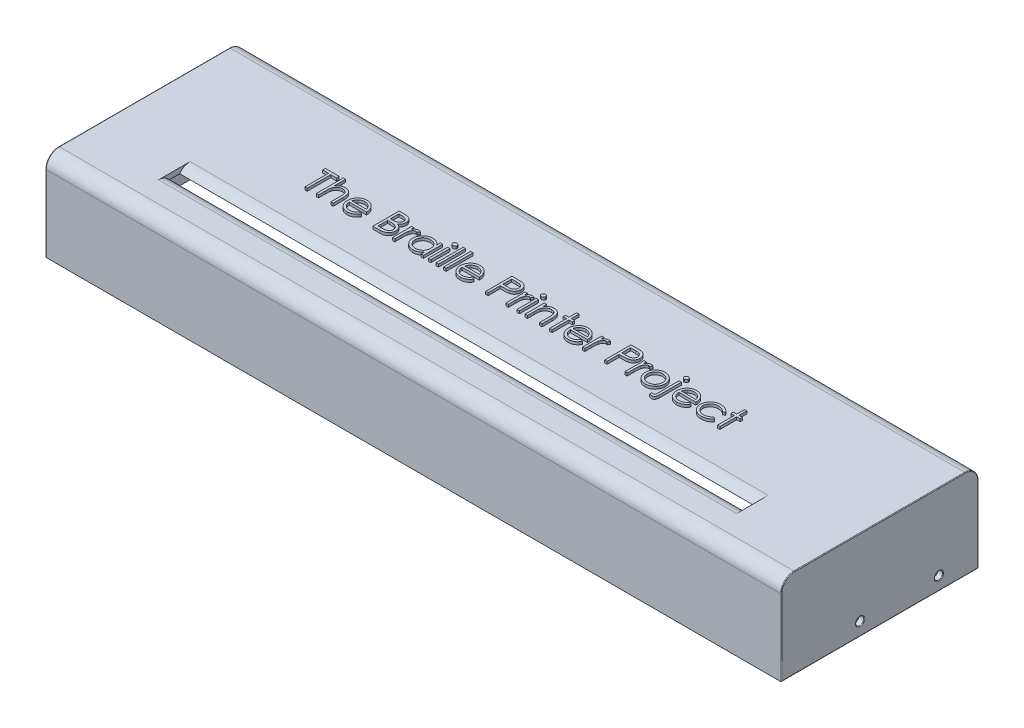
SolidWorks part; units mm, degrees
ref_plane "Piano frontale" through (0, 0, 0) normal (0, 0, 1) x (1, 0, 0)
ref_plane "Piano superiore" through (0, 0, 0) normal (0, 1, 0) x (1, 0, 0)
ref_plane "Piano destro" through (0, 0, 0) normal (1, 0, 0) x (0, 0, -1)
sketch "Schizzo1" plane through (0, 0, 0) normal (1, 0, 0) x (0, 0, -1)
  line L0 (-7.5, 10) -> (22.5, 10) construction
  line L1 (-32.5, 34) -> (32.5, 34)
  line L2 (-37.5, 29) -> (-37.5, 0)
  line L3 (7.5, 0) -> (7.5, 10) construction
  line L4 (37.5, 29) -> (37.5, 0)
  line L5 (-37.5, 0) -> (37.5, 0)
  circle A0 centre (-7.5, 10) radius 1.55 construction
  arc A1 (-32.5, 34) -> (-37.5, 29) centre (-32.5, 29) ccw
  arc A2 (32.5, 34) -> (37.5, 29) centre (32.5, 29) cw
  circle A3 centre (22.5, 10) radius 1.55 construction
  point P1 (0, 0)
  dimension "D1" = 34
  dimension "D3" = 5
  dimension "D4" = 3.1
  dimension "D2" = 75
  dimension "D5" = 10
  dimension "D6" = 30
  dimension "D7" = 30
extrude "Estrusione-Estrusione1" add sketch "Schizzo1" along normal blind 280
shell "Svuota1" thickness 2
sketch "Schizzo2" plane through (0, 34, 0) normal (0, 1, 0) x (1, 0, 0)
  line L0 (140, -18.5) -> (140, 37.5) construction
  line L1 (30, -20.5) -> (250, -20.5)
  line L2 (30, -20.5) -> (30, -16.5)
  line L3 (30, -16.5) -> (250, -16.5)
  line L4 (250, -20.5) -> (250, -16.5)
  line L5 (30, -20.5) -> (250, -16.5) construction
  line L6 (30, -16.5) -> (250, -20.5) construction
  line L7 (280, 37.5) -> (0, 37.5) construction
  point P0 (140, -18.5)
  dimension "D1" = 4
  dimension "D2" = 220
  dimension "D3" = 56
extrude "Taglio-Estrusione1" cut sketch "Schizzo2" against normal blind 10
sketch "Schizzo3" plane through (280, 0, 0) normal (1, 0, 0) x (0, 0, -1)
  line L0 (-7.5, 5) -> (22.5, 5) construction
  line L1 (7.5, 5) -> (7.5, 0) construction
  line L2 (-37.5, 0) -> (37.5, 0) construction
  circle A0 centre (22.5, 5) radius 1.55
  circle A1 centre (-7.5, 5) radius 1.55
  dimension "D1" = 3.1
  dimension "D2" = 30
  dimension "D3" = 5
  dimension "D4" = 30
extrude "Taglio-Estrusione2" cut sketch "Schizzo3" against normal up to next
fillet "Raccordo1" radius 5 2 edges at (140, 34, 16.5) (140, 34, 20.5)
sketch "Schizzo4" plane through (0, 0, 0) normal (-1, 0, 0) x (0, 0, 1)
  line L0 (-22.5, 5) -> (7.5, 5) construction
  line L1 (-7.5, 5) -> (-7.5, 0) construction
  line L2 (37.5, 0) -> (-37.5, 0) construction
  circle A0 centre (-22.5, 5) radius 1.55
  circle A1 centre (7.5, 5) radius 1.55
  dimension "D3" = 3.1
  dimension "D1" = 5
  dimension "D2" = 30
  dimension "D4" = 30
extrude "Taglio-Estrusione3" cut sketch "Schizzo4" against normal up to next
fillet "Raccordo2" radius 0.25 16 edges at (280, 34, 0) (280, 32.5355, -36.0355) (280, 14.5, -37.5) (280, 0, 0) (280, 14.5, 37.5) (280, 32.5355, 36.0355) (280, 5, -24.05) (280, 5, 5.95) (0, 14.5, 37.5) (0, 0, 0) (0, 14.5, -37.5) (0, 32.5355, -36.0355) (0, 34, 0) (0, 32.5355, 36.0355) (0, 5, -20.95) (0, 5, 9.05)
sketch "Schizzo5" plane through (0, 34, 0) normal (0, 1, 0) x (1, 0, 0)
  line L0 (0, 0) -> (279.75, 0) construction
  line L1 (279.75, -32.5) -> (279.75, 32.5) construction
  text T0 "The Braille Printer Project" font "Century Gothic" height 10
extrude "Estrusione-Estrusione2" add sketch "Schizzo5" along normal blind 1
